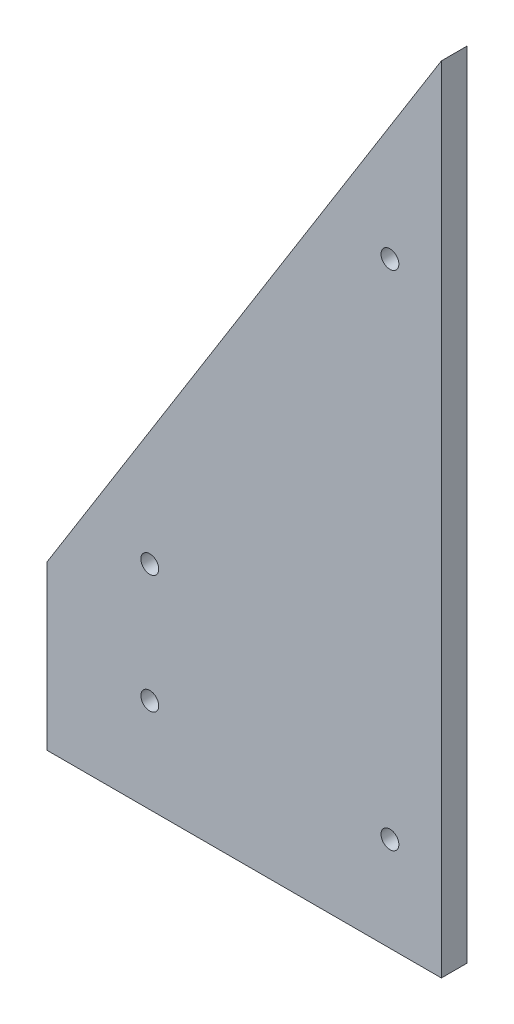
SolidWorks part; units mm, degrees
ref_plane "Front Plane" through (0, 0, 0) normal (0, 0, 1) x (1, 0, 0)
ref_plane "Top Plane" through (0, 0, 0) normal (0, 1, 0) x (1, 0, 0)
ref_plane "Right Plane" through (0, 0, 0) normal (1, 0, 0) x (0, 0, -1)
sketch "Sketch1" plane through (0, 0, 0) normal (0, 0, 1) x (1, 0, 0)
  line L0 (0, 0) -> (0, 60.325)
  line L1 (0, 60.325) -> (146.05, 294.0539)
  line L2 (146.05, 0) -> (0, 0)
  line L3 (146.05, 0) -> (146.05, 294.0539)
  dimension "D1" = 60.325
  dimension "D2" = 146.05
  dimension "D3" = 58
extrude "Extrude1" add sketch "Sketch1" along normal blind 9.525
sketch "Sketch2" plane through (0, 0, 9.525) normal (0, 0, 1) x (1, 0, 0)
  line L0 (0, 60.325) -> (0, 0) construction
  line L1 (0, 0) -> (146.05, 0) construction
  circle A0 centre (38.1, 78.74) radius 3.302
  circle A1 centre (127, 34.925) radius 3.302
  circle A2 centre (127, 220.98) radius 3.302
  circle A3 centre (38.1, 34.925) radius 3.302
  dimension "D4" = 6.604
  dimension "D5" = 34.925
  dimension "D6" = 78.74
  dimension "D1" = 38.1
  dimension "D2" = 127
  dimension "D3" = 220.98
  dimension "D7" = 34.925
extrude "Extrude2" cut sketch "Sketch2" against normal blind 9.525
